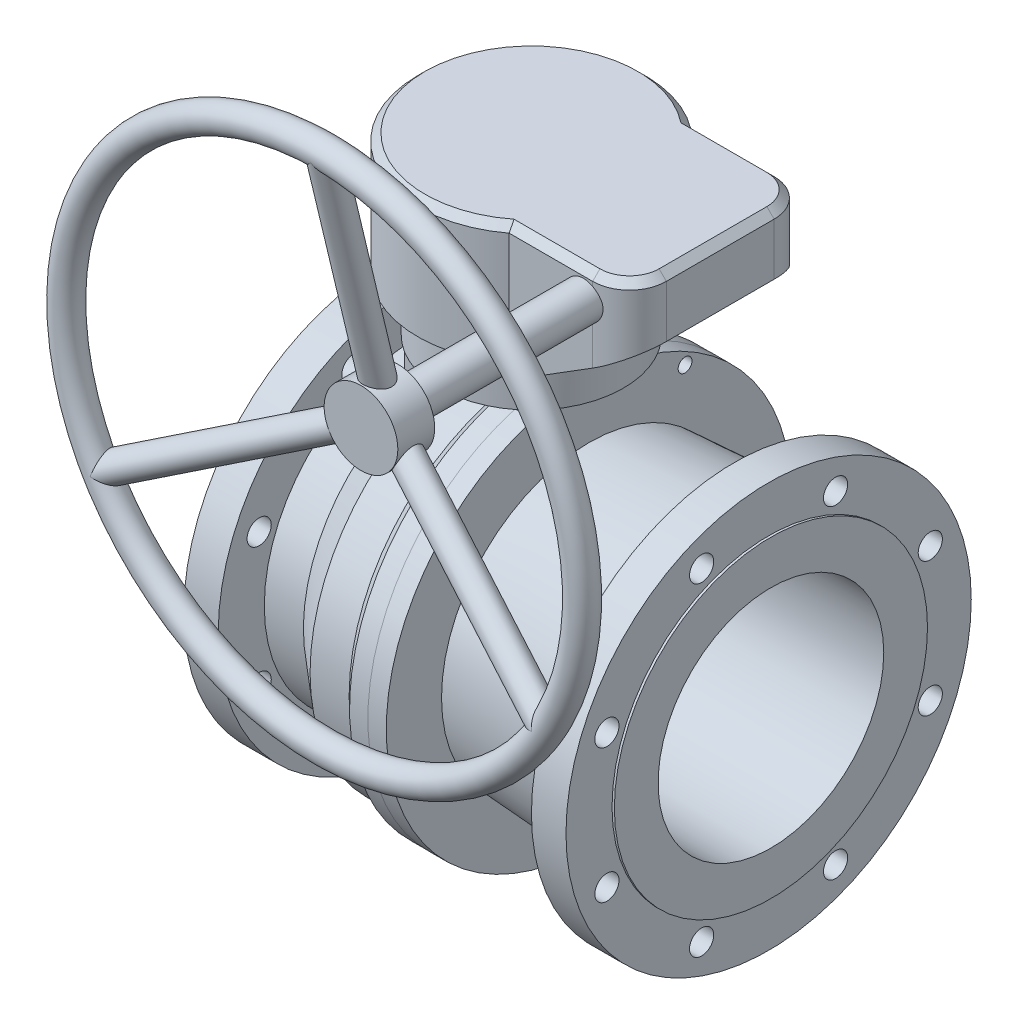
SolidWorks part; units mm, degrees
ref_plane "Front" through (0, 0, 0) normal (0, 0, 1) x (1, 0, 0)
ref_plane "Top" through (0, 0, 0) normal (0, 1, 0) x (1, 0, 0)
ref_plane "Right" through (0, 0, 0) normal (1, 0, 0) x (0, 0, -1)
imported_body "Imported1"
hole_wizard "3/4-10 Tapped Hole1" positions "Sketch2" profile "Sketch1" tap size "3/4-10" standard "Ansi Inch"
sketch "Sketch2" plane through (265.1125, 0, 0) normal (1, 0, 0) x (0, 0, -1)
  line L0 (0, 0) -> (0, 162.4557) construction
  line L3 (0, 0) -> (46.1708, 111.4661) construction
  circle A0 centre (0, 0) radius 120.65
  point P0 (46.1708, 111.4661)
  dimension "D2" = 241.3
  dimension "D1" = 22.5
sketch "Sketch1" plane through (265.1125, 111.4661, -46.1708) normal (0, 1, 0) x (0, 0, -1)
  line L0 (0, 0) -> (0, 197.6353)
  line L1 (0, 197.6353) -> (8.3337, 197.6353)
  line L2 (8.3337, 197.6353) -> (8.3337, 0)
  line L5 (8.3337, 0) -> (0, 0)
  line L11 (0, -6.35) -> (0, 107.95) construction
  dimension "Thru Tap Drill Dia." = 16.6675
  dimension "Thru Tap Drill Depth" = 197.6353
hole_wizard "3/4-10 Tapped Hole2" positions "Sketch4" profile "Sketch3" tap size "3/4-10" standard "Ansi Inch"
sketch "Sketch4" plane through (1.5875, 2.9093, 33.5112) normal (1, 0, 0) x (0, 0, -1)
  circle A0 centre (79.682, 108.5568) radius 8.3337 construction
  point P0 (79.682, 108.5568)
sketch "Sketch3" plane through (1.5875, 111.4661, -46.1708) normal (0, 1, 0) x (0, 0, 1)
  line L0 (0, 0) -> (0, 139.6365)
  line L1 (0, 139.6365) -> (8.3337, 139.6365)
  line L2 (8.3337, 139.6365) -> (8.3337, 0)
  line L5 (8.3337, 0) -> (0, 0)
  line L11 (0, -6.35) -> (0, 107.95) construction
  dimension "Thru Tap Drill Dia." = 16.6675
  dimension "Thru Tap Drill Depth" = 139.6365
chamfer "Chamfer1" distance 5 angle 45 6 edges at (177.6093, 266.7, -62.547) (224.3355, 266.7, -55.1075) (231.775, 266.7, 0) (224.3355, 266.7, 55.1075) (177.6093, 266.7, 62.547) (23.2157, 266.7, 0)
pattern_circular "CirPattern1" count 8 over 360 about axis through (0, 0, 0) along (1, 0, 0) of "3/4-10 Tapped Hole1", "3/4-10 Tapped Hole2"
sketch "Sketch5" plane through (0, 0, -62.547) normal (0, 0, -1) x (-1, 0, 0)
  line L0 (-206.375, 261.7) -> (-206.375, 209.9339) construction
  line L1 (-206.375, 266.7) -> (-147.1367, 266.7) construction
  circle A0 centre (-181.3502, 232.0828) radius 6.985
  dimension "D1" = 25.0248
  dimension "D3" = 13.97
  dimension "D2" = 34.6172
extrude "Cut-Extrude1" cut sketch "Sketch5" against normal blind 12.7
